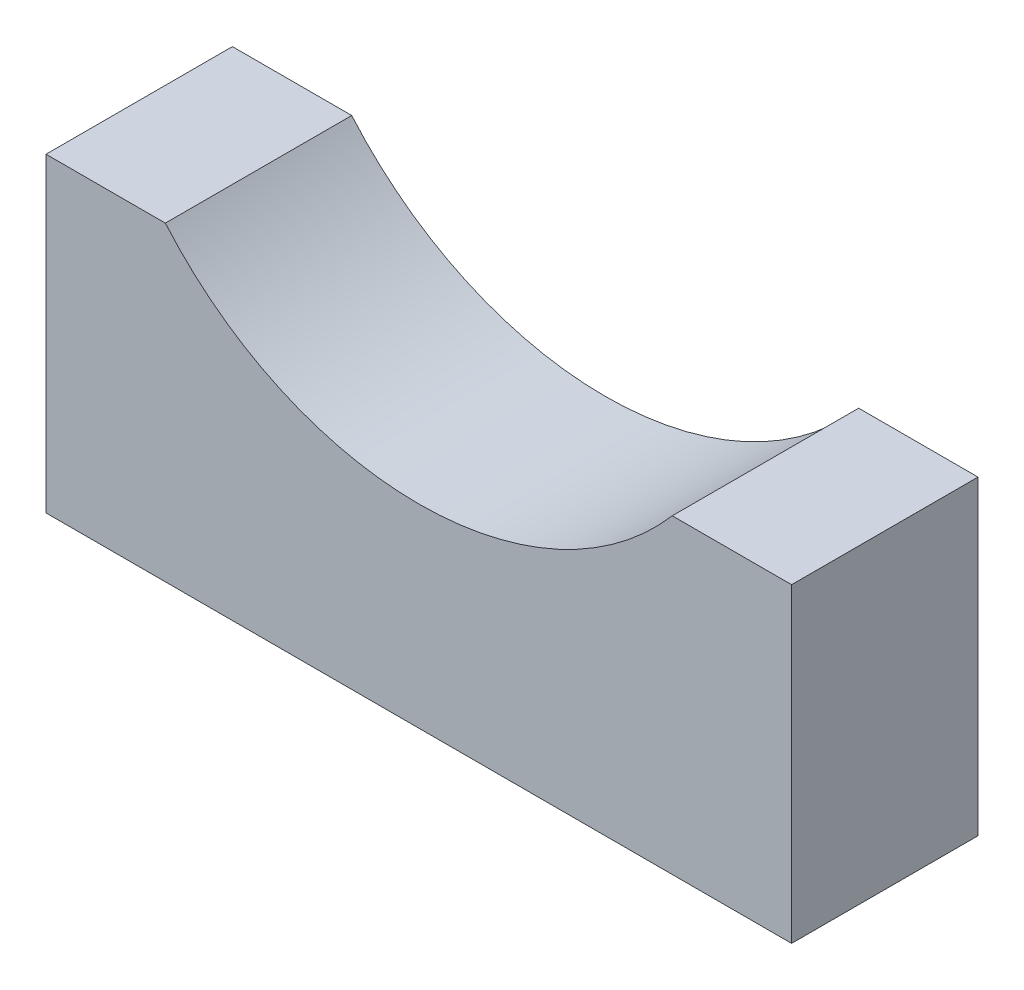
SolidWorks part; units mm, degrees
ref_plane "Front" through (0, 0, 0) normal (0, 0, 1) x (1, 0, 0)
ref_plane "Top" through (0, 0, 0) normal (0, 1, 0) x (1, 0, 0)
ref_plane "Right" through (0, 0, 0) normal (1, 0, 0) x (0, 0, -1)
sketch "Sketch1" plane through (0, 0, 0) normal (0, 0, 1) x (1, 0, 0)
  line L1 (-12, -5) -> (12, -5)
  line L2 (-12, -5) -> (-12, 5)
  line L3 (-12, 5) -> (12, 5)
  line L4 (12, -5) -> (12, 5)
  line L5 (-12, -5) -> (12, 5) construction
  line L6 (-12, 5) -> (12, -5) construction
  point P0 (0, 0)
  dimension "D1" = 24
  dimension "D2" = 10
extrude "Boss-Extrude1" add sketch "Sketch1" against normal blind 6
sketch "Sketch2" plane through (0, 0, 0) normal (0, 0, 1) x (1, 0, 0)
  line L0 (-12, -5) -> (12, -5) construction
  circle A0 centre (0, 12) radius 10.75
  dimension "D1" = 21.5
  dimension "D2" = 17
extrude "Cut-Extrude1" cut sketch "Sketch2" against normal through all
hole_wizard "M2.5x0.45 Tapped Hole1" positions "Sketch3" profile "Sketch4" tap size "M2.5x0.45" standard "ANSI Metric"
sketch "Sketch3" plane through (0, -5, 0) normal (0, -1, 0) x (-1, 0, 0)
  line L0 (-10.25, 3) -> (10.25, 3) construction
  line L1 (12, 6) -> (12, 0) construction
  point P0 (10.25, 3)
  point P2 (-10.25, 3)
  point P15 (12, 3)
sketch "Sketch4" plane through (-10.25, -5, -3) normal (1, 0, 0) x (0, 0, -1)
  line L0 (0, 0) -> (0, 5.6159)
  line L1 (0, 5.6159) -> (1.025, 5)
  line L2 (1.025, 5) -> (1.025, 0)
  line L5 (1.025, 0) -> (0, 0)
  line L10 (0, 5.6159) -> (-1.025, 5) construction
  line L11 (0, -6.35) -> (0, 107.95) construction
  dimension "Tap Drill Dia." = 2.05
  dimension "Tap Drill Depth" = 5
  dimension "Drill Angle" = 118
equation "\"D2@Sketch3\"=\"D1@Sketch3\"/2"
